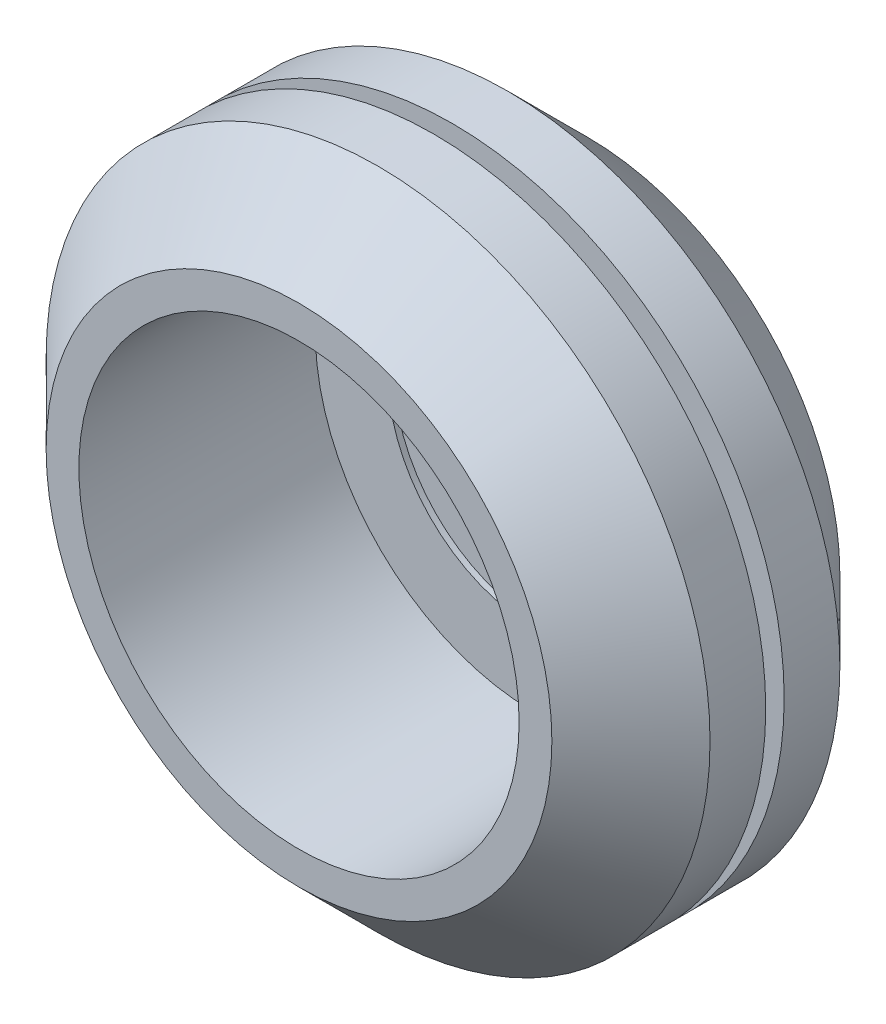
SolidWorks part; units mm, degrees
ref_plane "Front Plane" through (0, 0, 0) normal (0, 0, 1) x (1, 0, 0)
ref_plane "Top Plane" through (0, 0, 0) normal (0, 1, 0) x (1, 0, 0)
ref_plane "Right Plane" through (0, 0, 0) normal (1, 0, 0) x (0, 0, -1)
sketch "Sketch1" plane through (0, 0, 0) normal (0, 1, 0) x (1, 0, 0)
  line L0 (0, 0) -> (0, 2.267) construction
  line L4 (-7.1437, 1.397) -> (-7.1437, 0.1984)
  line L5 (-7.1437, 0.1984) -> (-6.35, 0.1984)
  line L6 (-4.7371, 1.9876) -> (-4.7371, -3.0988)
  line L7 (-7.1437, -0.1984) -> (-6.35, -0.1984)
  line L8 (0, 0) -> (-8.3919, 0) construction
  line L9 (-7.1437, -1.397) -> (-7.1437, -0.1984)
  line L10 (-4.7371, -3.0988) -> (-5.4419, -3.0988)
  line L13 (-7.1437, -1.397) -> (-5.4419, -3.0988)
  line L14 (-7.1437, 1.397) -> (-5.442, 3.0988)
  line L15 (-4.7371, 1.9876) -> (-3.175, 1.9876)
  line L16 (-5.442, 3.0988) -> (-1.905, 3.0988)
  line L18 (-1.905, 3.0988) -> (-1.905, 2.1146)
  line L21 (-3.175, 1.9876) -> (-3.175, 2.1146)
  line L22 (-3.175, 2.1146) -> (-1.905, 2.1146)
  arc A2 (-6.35, 0.1984) -> (-6.35, -0.1984) centre (-6.35, 0) cw
  point P19 (-4.7371, 0)
  dimension "D1" = 45
  dimension "D8" = 0.7937
  dimension "D2" = 0.1984
  dimension "D3" = 12.7
  dimension "D4" = 1.9876
  dimension "D5" = 9.4742
  dimension "D6" = 2.794
  dimension "D7" = 3.0988
  dimension "D9" = 6.35
  dimension "D10" = 3.81
  dimension "D12" = 0.127
revolve "Revolve6" add sketch "Sketch1" angle 360 about L0
